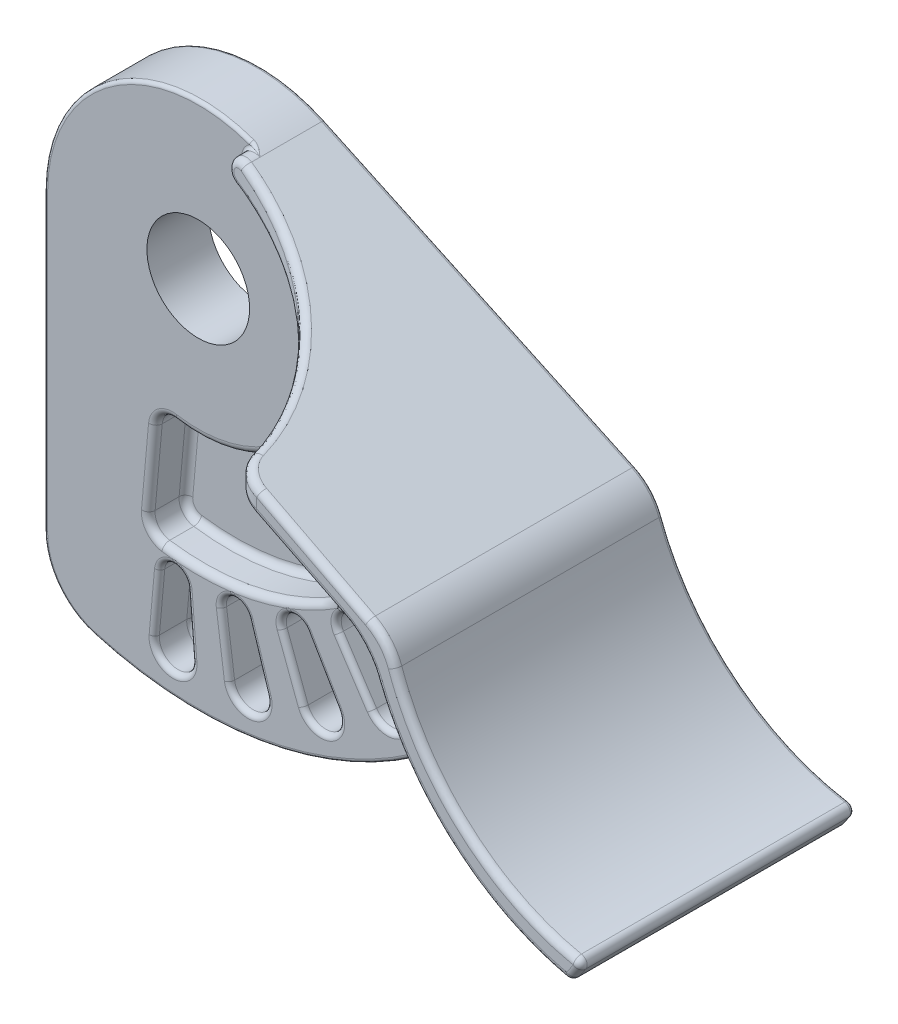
SolidWorks part; units mm, degrees
ref_plane "Plane1" through (0, 0, 0) normal (0, 0, 1) x (1, 0, 0)
ref_plane "Plane2" through (0, 0, 0) normal (0, 1, 0) x (1, 0, 0)
ref_plane "Plane3" through (0, 0, 0) normal (1, 0, 0) x (0, 0, -1)
sketch "Sketch1" plane through (0, 0, 0) normal (0, 0, 1) x (1, 0, 0)
  line L0 (-11.43, 0) -> (-11.43, -25.4)
  line L1 (4.8305, 10.3591) -> (27.8507, -0.3754)
  arc A0 (-11.43, 0) -> (4.8305, 10.3591) centre (0, 0) cw
  arc A1 (-11.43, -25.4) -> (27.8507, -0.3754) centre (0, 0) ccw
  dimension "D1" = 11.43
  dimension "D3" = 25.4
  dimension "D4" = 65
extrude "Base-Extrude" add sketch "Sketch1" along normal blind 4.572
sketch "Sketch2" plane through (0, 0, 0) normal (0, 0, -1) x (-1, 0, 0)
  line L0 (-43.9749, -14.7449) -> (-43.4698, -15.4658)
  line L1 (-4.8305, 10.3591) -> (-27.8507, -0.3754) construction
  line L2 (-4.8305, 10.3591) -> (-27.8507, -0.3754)
  line L3 (-27.7781, -2.0454) -> (-4.043, 8.6406)
  arc A0 (-27.8507, -0.3754) -> (-29.8613, -2.5604) centre (-26.203, -3.909) ccw
  arc A1 (-29.8613, -2.5604) -> (-43.6418, -13.9521) centre (-46.5438, 3.5894) cw
  arc A2 (-42.9608, -15.6737) -> (-27.7781, -2.0454) centre (-46.5438, 3.5894) ccw
  arc A3 (-27.8507, -0.3754) -> (11.43, -25.4) centre (0, 0) ccw construction
  arc A5 (-4.8305, 10.3591) -> (-4.043, 8.6406) centre (-4.4311, 9.5025) cw
  arc A7 (-43.9749, -14.7449) -> (-43.6418, -13.9521) centre (-43.5589, -14.4533) cw
  arc A8 (-43.4698, -15.4658) -> (-42.9608, -15.6737) centre (-43.0537, -15.1742) ccw
  point P19 (-27.7781, -2.0454)
  point P22 (-44.45, -14.0669)
  point P25 (-43.2839, -15.731)
  dimension "D1" = 3.8989
  dimension "D7" = 0.508
  dimension "D8" = 0.508
  dimension "D2" = 2.185
  dimension "D4" = 2.032
  dimension "D5" = 44.45
extrude "Boss-Extrude1" add sketch "Sketch2" against normal blind 20.701
fillet "Fillet3" radius 2.54
ref_plane "Plane4" through (0, -24.4792, 0) normal (0, 1, 0) x (-1, 0, 0)
sketch "Sketch3" plane through (0, -24.4792, 0) normal (0, 1, 0) x (1, 0, 0)
  line L0 (3.4859, -4.572) -> (3.4859, -20.701) construction
  line L1 (19.2738, -19.5135) -> (53.5483, -20.6133)
  line L2 (3.4859, -5.8256) -> (-0.5663, -5.8256)
  line L3 (-0.5663, -5.8256) -> (-0.5663, -22.5609)
  line L4 (-0.5663, -22.5609) -> (55.077, -22.5609)
  line L5 (55.077, -22.5609) -> (55.077, -20.6133)
  line L6 (55.077, -20.6133) -> (53.5483, -20.6133)
  arc A0 (3.4859, -5.8256) -> (17.2893, -17.854) centre (2.3779, -21.0316) cw
  arc A1 (17.2893, -17.854) -> (19.2738, -19.5135) centre (19.3411, -17.4168) ccw
extrude "Cut-Extrude1" cut sketch "Sketch3" along normal through all
fillet "Fillet4" radius 5.08
fillet "Fillet6" radius 0.508
fillet "Fillet8" radius 0.254
fillet "Fillet10" radius 5.08
fillet "Fillet9" radius 0.254
sketch "Sketch4" plane through (0, 0, 4.572) normal (0, 0, 1) x (1, 0, 0)
  circle A0 centre (0, 0) radius 3.81
  arc A1 (3.7878, 10.5145) -> (-11.176, 0) centre (0, 0) ccw construction
  dimension "D1" = 7.62
extrude "Cut-Extrude2" cut sketch "Sketch4" against normal through all
sketch "Sketch5" plane through (0, 0, 4.572) normal (0, 0, 1) x (1, 0, 0)
  line L0 (18.1137, -3.9624) -> (10.0721, -1.3336)
  line L1 (-3.048, -9.692) -> (-3.81, -18.1463)
  line L2 (-11.176, 0) -> (-11.176, -21.8701) construction
  line L3 (-11.43, -21.8701) -> (-11.43, 0) construction
  line L4 (19.5048, 3.5164) -> (27.8507, -0.3754) construction
  line L5 (18.0009, 4.2177) -> (4.8305, 10.3591) construction
  arc A0 (-3.048, -9.692) -> (10.0721, -1.3336) centre (0, 0) ccw
  arc A1 (-3.81, -18.1463) -> (18.1137, -3.9624) centre (0, 0) ccw
  arc A2 (-7.6957, -26.5047) -> (26.1673, -8.7747) centre (0, 0) ccw construction
  dimension "D1" = 10.16
  dimension "D2" = 18.542
  dimension "D3" = 8.382
  dimension "D4" = 7.366
  dimension "D5" = 8.382
  dimension "D6" = 7.366
extrude "Cut-Extrude3" cut sketch "Sketch5" against normal blind 2.794
fillet "Fillet11" radius 1.27
fillet "Fillet13" radius 0.508
sketch "Sketch6" plane through (0, 0, 4.572) normal (0, 0, 1) x (1, 0, 0)
  line L0 (-2.8623, -20.2627) -> (-3.263, -24.7077)
  line L1 (-4.2113, -16.9391) -> (-3.6858, -11.1088) construction
  line L2 (-0.8377, -20.2723) -> (-0.4791, -24.7208)
  arc A0 (-2.8623, -20.2627) -> (-0.8377, -20.2723) centre (-1.8504, -20.3539) cw
  arc A1 (-0.4791, -24.7208) -> (-3.263, -24.7077) centre (-1.8716, -24.8331) cw
  arc A3 (-2.6916, -18.8589) -> (18.2993, -5.2951) centre (0, 0) ccw construction
  dimension "D1" = 1.016
  dimension "D2" = 1.397
  dimension "D5" = 20.4378
  dimension "D3" = 4.445
  dimension "D4" = 1.6418
extrude "Cut-Extrude4" cut sketch "Sketch6" against normal blind 2.794
fillet "Fillet14" radius 0.381
pattern_circular "CirPattern2" count 6 every 12.857
